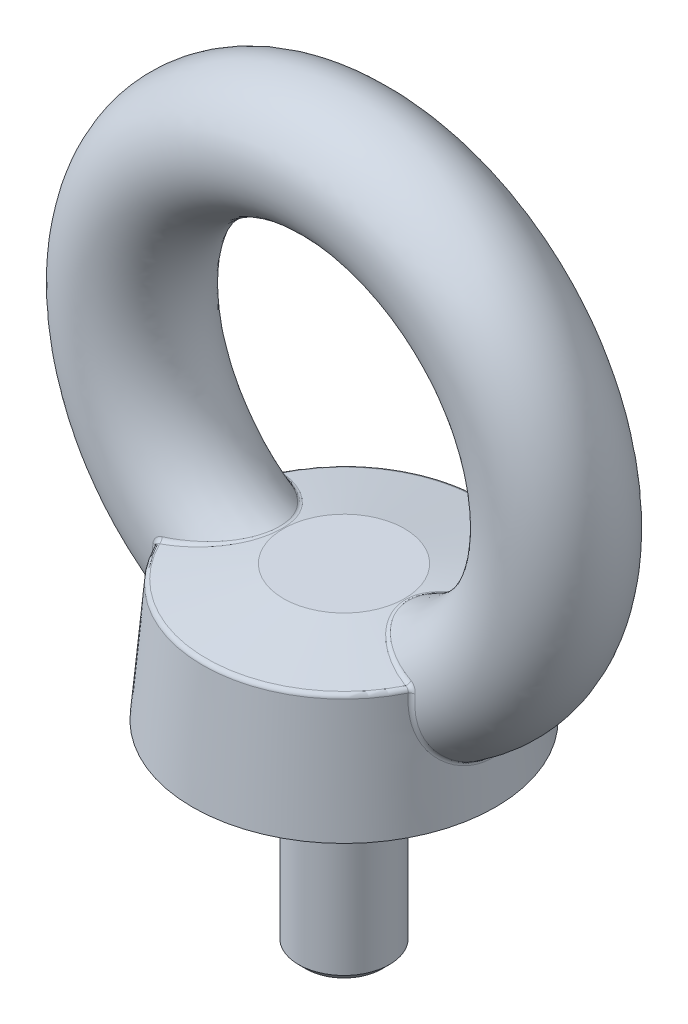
SolidWorks part; units mm, degrees
ref_plane "Front Plane" through (0, 0, 0) normal (0, 0, 1) x (1, 0, 0)
ref_plane "Top Plane" through (0, 0, 0) normal (0, 1, 0) x (1, 0, 0)
ref_plane "Right Plane" through (0, 0, 0) normal (1, 0, 0) x (0, 0, -1)
sketch "Sketch1" plane through (0, 0, 0) normal (0, 0, 1) x (1, 0, 0)
  ellipse E0 centre (0, 18) end of major axis (-18, 18) minor radius 18
  dimension "D1" = 36
  dimension "D2" = 36
sketch "Sketch2" plane through (0, 0, 0) normal (1, 0, 0) x (0, 0, -1)
  line L3 (0, 36) -> (0, 0) construction
  circle A0 centre (0, 4) radius 4
  point P5 (0, 0)
sweep "Sweep1" add profiles "Sketch2" path "Sketch1"
sketch "Sketch3" plane through (0, 0, 0) normal (1, 0, 0) x (0, 0, -1)
  line L0 (0, 0) -> (-10, 0)
  line L1 (-10, 0) -> (-9.3001, 8)
  line L2 (-9.3001, 8) -> (-4, 8.9345)
  line L3 (-4, 8.9345) -> (0, 8.9345)
  line L4 (0, 8.9345) -> (0, 0)
revolve "Revolve1" add sketch "Sketch3" angle 360 about L4
fillet "Fillet1" radius 0.3 6 edges at (4.1895, 8.8979, 0.3945) (9.7395, 2.8856, 0.3955) (-4.1895, 8.8979, -0.3945) (-9.7395, 2.8856, -0.3955) (0, 8, -9.3001) (0, 8, 9.3001)
sketch "Sketch4" plane through (0, 0, 0) normal (0, -1, 0) x (1, 0, 0)
  circle A0 centre (0, 0) radius 3
  dimension "D1" = 6
extrude "Extrude1" add sketch "Sketch4" along normal blind 13
chamfer "Chamfer1" distance 0.5 angle 45 1 edges at (0, -13, -3)
sketch "Sketch5" plane through (0, 0, 0) normal (1, 0, 0) x (0, 0, -1)
  line L0 (-3, 0) -> (-3, -1.366)
  line L1 (-3, 0) -> (-3, -12.5) construction
  line L2 (-2.5, -0.5) -> (-3, -1.366)
  line L3 (-2.5, -0.5) -> (-2.5, -0.25)
  line L4 (-2.75, 0) -> (-3, 0)
  line L5 (-2.75, -0.25) -> (-2.5, -0.25) construction
  arc A1 (-2.5, -0.25) -> (-2.75, 0) centre (-2.75, -0.25) ccw
  point P0 (-2.5, -13)
  dimension "D1" = 30
revolve "Cut-Revolve1" cut sketch "Sketch5" angle 360 about axis through (0, -13, 0) along (0, 1, 0)
equation "\"D4@Sketch3\" = \"D1@Sketch2\""
equation "\"D5@Sketch3\" = \"D1@Sketch2\"/2"
